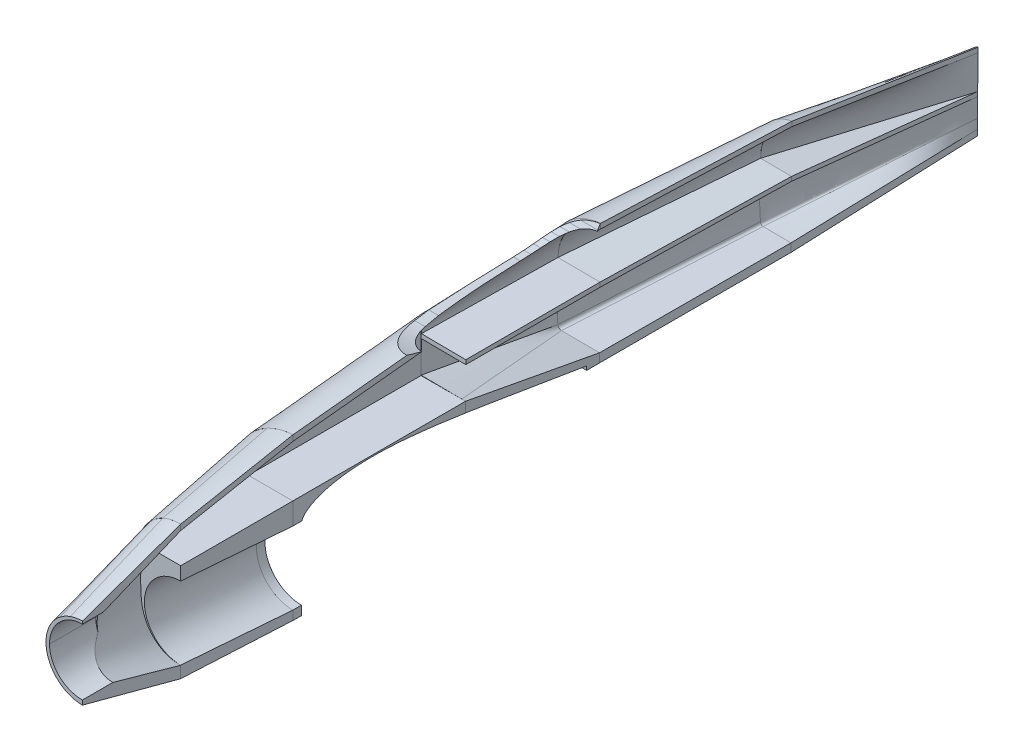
SolidWorks part; units mm, degrees
ref_plane "Plan de face" through (0, 0, 0) normal (0, 0, 1) x (1, 0, 0)
ref_plane "Plan de dessus" through (0, 0, 0) normal (0, 1, 0) x (1, 0, 0)
ref_plane "Plan de droite" through (0, 0, 0) normal (1, 0, 0) x (0, 0, -1)
imported_body "T1-4-solid1"
imported_body "T2-2-solid1"
imported_body "T3-3-solid1"
imported_body "T4-1-solid1"
imported_body "T5-1-solid1"
imported_body "T6-1-solid1"
mirror "Symétrie1" about plane through (0, 0, 0) normal (1, 0, 0)
